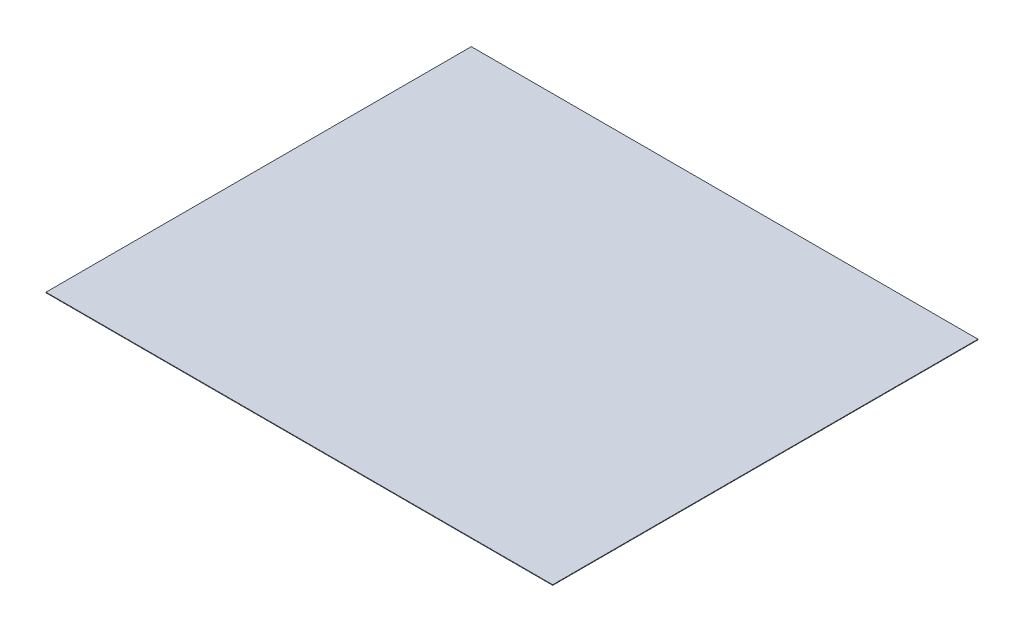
SolidWorks part; units mm, degrees
ref_plane "Vorderseite" through (0, 0, 0) normal (0, 0, 1) x (1, 0, 0)
ref_plane "Oben" through (0, 0, 0) normal (0, 1, 0) x (1, 0, 0)
ref_plane "Rechts" through (0, 0, 0) normal (1, 0, 0) x (0, 0, -1)
sketch "Skizze1" plane through (0, 0, 0) normal (0, 1, 0) x (1, 0, 0)
  line L0 (1000, -1500) -> (1000, 5000) construction
  line L1 (1000, 5000) -> (6000, 5000) construction
  line L2 (6000, -618.3651) -> (1000, -1500) construction
  line L3 (6000, -618.3651) -> (6000, 5000) construction
  line L4 (0, -50) -> (0, 50) construction
  line L5 (-50, 0) -> (50, 0) construction
  line L7 (-46547.8081, -41093.7965) -> (43830.5373, -41093.7965)
  line L8 (-46547.8081, -41093.7965) -> (-46547.8081, 34760.7804)
  line L9 (-46547.8081, 34760.7804) -> (43830.5373, 34760.7804)
  line L10 (43830.5373, -41093.7965) -> (43830.5373, 34760.7804)
  dimension "D1" = 1000
  dimension "D2" = 5000
  dimension "D3" = 5000
  dimension "D4" = 10
  dimension "D5" = 1500
extrude "Aufsatz-Linear austragen1" add sketch "Skizze1" against normal blind 100
